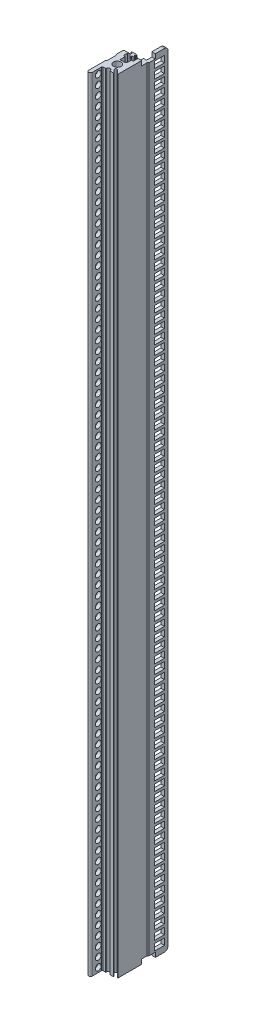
SolidWorks part; units mm, degrees
ref_plane "前视基准面" through (0, 0, 0) normal (0, 0, 1) x (1, 0, 0)
ref_plane "上视基准面" through (0, 0, 0) normal (0, 1, 0) x (1, 0, 0)
ref_plane "右视基准面" through (0, 0, 0) normal (1, 0, 0) x (0, 0, -1)
sketch "草图1" plane through (0, 0, 0) normal (0, 1, 0) x (1, 0, 0)
  line L0 (-4.2, 11.9) -> (-3.9, 11.9)
  line L1 (-4.4, 12.2) -> (-4.4, 12.1)
  line L2 (-4.0328, 12.4) -> (-4.2, 12.4)
  line L3 (-3.85, 12.5) -> (-3.8914, 12.4586)
  line L4 (-2.05, 12.5) -> (-3.85, 12.5)
  line L5 (-2.0086, 12.4586) -> (-2.05, 12.5)
  line L6 (-1.7, 12.4) -> (-1.8672, 12.4)
  line L7 (-1.5, 12.1) -> (-1.5, 12.2)
  line L8 (-1.8, 11.9) -> (-1.7, 11.9)
  line L9 (-2, 11.4828) -> (-2, 11.7)
  line L10 (-1.3586, 10.7586) -> (-1.9414, 11.3414)
  line L11 (-1.3, 10.55) -> (-1.3, 10.6172)
  line L12 (-3.7, 11.7) -> (-3.7, 9.95)
  line L13 (-5, -10.75) -> (-5, -1.6)
  line L14 (-3, -10.75) -> (-3, -5.75)
  line L15 (-2.5, -5.25) -> (-1.15, -5.25)
  line L16 (1.6887, -3.3855) -> (3.2118, -4.9086)
  line L17 (2.5373, -2.537) -> (4.6586, -4.6583)
  line L18 (5, 15) -> (5, 5.1793)
  line L19 (3.6, 15) -> (5, 15)
  line L20 (3.6, 12.5) -> (3.6, 15)
  line L21 (1.95, 12.5) -> (3.6, 12.5)
  line L22 (1.95, 10.55) -> (1.95, 12.5)
  line L23 (2.85, 10.55) -> (1.95, 10.55)
  line L24 (2.85, 9.35) -> (2.85, 10.55)
  line L25 (1.95, 9.35) -> (2.85, 9.35)
  line L26 (1.95, 8.35) -> (1.95, 9.35)
  line L27 (2.85, 8.35) -> (1.95, 8.35)
  line L28 (2.85, 6.05) -> (2.85, 8.35)
  line L29 (1.95, 6.05) -> (2.85, 6.05)
  line L30 (1.95, 3.8856) -> (1.95, 6.05)
  line L31 (-1.45, 6.05) -> (-1.45, 2.9458)
  line L32 (-2.35, 6.05) -> (-1.45, 6.05)
  line L33 (-2.35, 8.35) -> (-2.35, 6.05)
  line L34 (-1.45, 8.35) -> (-2.35, 8.35)
  line L35 (-1.45, 9.35) -> (-1.45, 8.35)
  line L36 (-2.35, 9.35) -> (-1.45, 9.35)
  line L37 (-2.35, 10.55) -> (-2.35, 9.35)
  line L38 (-1.3, 10.55) -> (-2.35, 10.55)
  line L39 (-4.45, 7.7) -> (-4.7, 7.7) construction
  line L40 (-5, 7.4) -> (-4.7, 7.7) construction
  line L41 (-5, 4.4) -> (-5, 7.4)
  line L42 (-4.5499, 3.8998) -> (-5, 4.4)
  line L43 (-4.45, 8.5) -> (-4.45, 9.55)
  line L44 (-3.9, 9.75) -> (-4.25, 9.75)
  line L45 (-4.5499, 3.8998) -> (-4.5501, -1.1002)
  line L46 (-5, -1.6) -> (-4.5501, -1.1002)
  line L47 (4.9414, -1.9395) -> (4.6464, -1.6446) construction
  line L48 (5, -2.081) -> (5, -4.5169)
  line L49 (0, 0) -> (0, -5) construction
  line L50 (4.5, -1.291) -> (4.5, 4.3894) construction
  line L51 (-1.05, -5) -> (-1.05, -5.15)
  line L52 (1.05, -5) -> (1.05, -5.15)
  line L53 (1.15, -5.25) -> (3.0703, -5.25)
  line L54 (2.5373, -2.537) -> (1.6887, -3.3855) construction
  line L55 (5, 5.1793) -> (5, -2.081)
  line L56 (-4.45, 8.5) -> (-4.7, 8.5)
  line L57 (-4.7, 8.5) -> (-5, 8.2)
  line L58 (4.9414, 5.0379) -> (4.6464, 4.743) construction
  line L59 (-5, 8.2) -> (-5, 7.4)
  circle A0 centre (0, 0) radius 1.6
  arc A1 (-4.4, 12.1) -> (-4.2, 11.9) centre (-4.2, 12.1) ccw
  arc A2 (-4.2, 12.4) -> (-4.4, 12.2) centre (-4.2, 12.2) ccw
  arc A3 (-4.0328, 12.4) -> (-3.8914, 12.4586) centre (-4.0328, 12.6) ccw
  arc A4 (-2.0086, 12.4586) -> (-1.8672, 12.4) centre (-1.8672, 12.6) ccw
  arc A5 (-1.5, 12.2) -> (-1.7, 12.4) centre (-1.7, 12.2) ccw
  arc A6 (-1.7, 11.9) -> (-1.5, 12.1) centre (-1.7, 12.1) ccw
  arc A7 (-1.8, 11.9) -> (-2, 11.7) centre (-1.8, 11.7) ccw
  arc A8 (-2, 11.4828) -> (-1.9414, 11.3414) centre (-1.8, 11.4828) ccw
  arc A9 (-1.3, 10.6172) -> (-1.3586, 10.7586) centre (-1.5, 10.6172) ccw
  arc A10 (-5, -10.75) -> (-3, -10.75) centre (-4, -10.75) ccw
  arc A11 (3.0703, -5.25) -> (3.2118, -4.9086) centre (3.0703, -5.05) ccw
  arc A12 (-4.25, 9.75) -> (-4.45, 9.55) centre (-4.25, 9.55) ccw
  arc A13 (-3.9, 9.75) -> (-3.7, 9.95) centre (-3.9, 9.95) ccw
  arc A14 (5, -2.081) -> (4.9414, -1.9395) centre (4.8, -2.081) ccw construction
  arc A15 (4.9414, 5.0379) -> (5, 5.1793) centre (4.8, 5.1793) ccw construction
  arc A16 (4.6586, -4.6583) -> (5, -4.5169) centre (4.8, -4.5169) ccw
  arc A17 (2.5373, -2.537) -> (1.6887, -3.3855) centre (2.113, -2.9613) ccw
  arc A18 (0.7125, 2.9142) -> (-1.1719, 2.7616) centre (0, 0) ccw
  arc A19 (-1.45, 2.9458) -> (-1.1719, 2.7616) centre (-1.25, 2.9458) ccw
  arc A20 (0.7125, 2.9142) -> (1.95, 3.8856) centre (0.95, 3.8856) ccw
  arc A21 (-3.7, 11.7) -> (-3.9, 11.9) centre (-3.9, 11.7) ccw
  arc A22 (4.6464, -1.6446) -> (4.5, -1.291) centre (5, -1.291) cw construction
  arc A23 (4.5, 4.3894) -> (4.6464, 4.743) centre (5, 4.3894) cw construction
  arc A24 (1.05, -5) -> (-1.05, -5) centre (0, -5) ccw
  arc A25 (1.15, -5.25) -> (1.05, -5.15) centre (1.15, -5.15) cw
  arc A26 (-1.05, -5.15) -> (-1.15, -5.25) centre (-1.15, -5.15) cw
  arc A29 (-3, -5.75) -> (-2.5, -5.25) centre (-2.5, -5.75) cw
  point P104 (1.05, -5.25)
  dimension "D1" = 3.2
  dimension "D2" = 2.1
  dimension "D3" = 5.2
  dimension "D4" = 45
  dimension "D5" = 1.2
  dimension "D7" = 0.6
  dimension "D8" = 0.2
  dimension "D10" = 5
  dimension "D11" = 0.1
  dimension "D12" = 0.5
  dimension "D13" = 0.5
  dimension "D6" = 3
  dimension "D9" = 2.1225
  dimension "D14" = 0.25
  dimension "D15" = 0.8
extrude "凸台-拉伸1" add sketch "草图1" along normal mid plane 431.8
sketch "草图8" plane through (0, -215.9, 0) normal (0, -1, 0) x (-1, 0, 0)
  line L0 (2.35, 8.35) -> (1.45, 8.35) construction
  line L1 (-2.95, 5.85) -> (2.45, 5.85)
  line L2 (-2.95, 5.85) -> (-2.95, 8.35)
  line L3 (-2.95, 8.35) -> (2.45, 8.35)
  line L4 (2.45, 5.85) -> (2.45, 8.35)
  line L5 (-2.85, 8.35) -> (-2.85, 6.05) construction
  line L6 (2.35, 6.05) -> (2.35, 8.35) construction
  line L7 (1.45, 6.05) -> (2.35, 6.05) construction
  line L8 (-2.85, 9.35) -> (-1.95, 9.35) construction
  line L9 (-2.95, 9.35) -> (2.45, 9.35)
  line L10 (-2.95, 9.35) -> (-2.95, 10.55)
  line L11 (-2.95, 10.55) -> (2.45, 10.55)
  line L12 (2.45, 9.35) -> (2.45, 10.55)
  line L13 (2.35, 10.55) -> (1.3, 10.55) construction
  line L14 (-2.85, 10.55) -> (-2.85, 9.35) construction
  line L15 (2.35, 9.35) -> (2.35, 10.55) construction
  dimension "D1" = 0.1
  dimension "D2" = 0.1
  dimension "D3" = 0.2
  dimension "D4" = 0.1
  dimension "D5" = 0.1
extrude "切除-拉伸6" cut sketch "草图8" against normal through all
fillet "圆角2" radius 0.2 8 edges at (-2.45, 0, -5.85) (2.95, 0, -8.35) (2.95, 0, -5.85) (-2.45, 0, -8.35) (-2.45, 0, -9.35) (2.95, 0, -10.55) (2.95, 0, -9.35) (-2.45, 0, -10.55)
sketch "草图6" plane through (0, 215.9, 0) normal (0, 1, 0) x (1, 0, 0)
  line L0 (3.6, 12.5) -> (3.6, 22.5)
  line L1 (3.6, 22.5) -> (5.5, 22.5)
  line L2 (5.5, 22.5) -> (5.5, 12)
  line L3 (5.5, 12) -> (5, 11.5)
  line L4 (3.6, 12.5) -> (5, 11.5)
  line L5 (5, -4.5169) -> (5, 15) construction
  line L6 (-5, 8.2) -> (-5, 4.4) construction
  dimension "D4" = 11
  dimension "D1" = 10.5
  dimension "D2" = 10
  dimension "D3" = 45
extrude "凸台-拉伸2" add sketch "草图6" against normal up to surface (431.8 mm away)
sketch "草图2" plane through (0, 215.9, 0) normal (0, 1, 0) x (1, 0, 0)
  circle A0 centre (0, 0) radius 2.1
  dimension "D1" = 4.2
extrude "切除-拉伸1" cut sketch "草图2" against normal blind 10
sketch "草图3" plane through (0, -215.9, 0) normal (0, -1, 0) x (1, 0, 0)
  circle A0 centre (0, 0) radius 2.1
  dimension "D1" = 4.2
extrude "切除-拉伸2" cut sketch "草图3" against normal blind 10
sketch "草图4" plane through (-5, 0, 0) normal (-1, 0, 0) x (0, 0, 1)
  line L0 (1.6, -215.9) -> (10.75, -215.9) construction
  line L1 (11.75, -215.9) -> (11.75, 215.9) construction
  circle A0 centre (7.5, -213.36) radius 1.65
  circle A1 centre (7.5, -208.28) radius 1.65
  circle A2 centre (7.5, -203.2) radius 1.65
  circle A3 centre (7.5, -198.12) radius 1.65
  circle A4 centre (7.5, -193.04) radius 1.65
  circle A5 centre (7.5, -187.96) radius 1.65
  circle A6 centre (7.5, -182.88) radius 1.65
  circle A7 centre (7.5, -177.8) radius 1.65
  circle A8 centre (7.5, -172.72) radius 1.65
  circle A9 centre (7.5, -167.64) radius 1.65
  circle A10 centre (7.5, -162.56) radius 1.65
  circle A11 centre (7.5, -157.48) radius 1.65
  circle A12 centre (7.5, -152.4) radius 1.65
  circle A13 centre (7.5, -147.32) radius 1.65
  circle A14 centre (7.5, -142.24) radius 1.65
  circle A15 centre (7.5, -137.16) radius 1.65
  circle A16 centre (7.5, -132.08) radius 1.65
  circle A17 centre (7.5, -127) radius 1.65
  circle A18 centre (7.5, -121.92) radius 1.65
  circle A19 centre (7.5, -116.84) radius 1.65
  circle A20 centre (7.5, -111.76) radius 1.65
  circle A21 centre (7.5, -106.68) radius 1.65
  circle A22 centre (7.5, -101.6) radius 1.65
  circle A23 centre (7.5, -96.52) radius 1.65
  circle A24 centre (7.5, -91.44) radius 1.65
  circle A25 centre (7.5, -86.36) radius 1.65
  circle A26 centre (7.5, -81.28) radius 1.65
  circle A27 centre (7.5, -76.2) radius 1.65
  circle A28 centre (7.5, -71.12) radius 1.65
  circle A29 centre (7.5, -66.04) radius 1.65
  circle A30 centre (7.5, -60.96) radius 1.65
  circle A31 centre (7.5, -55.88) radius 1.65
  circle A32 centre (7.5, -50.8) radius 1.65
  circle A33 centre (7.5, -45.72) radius 1.65
  circle A34 centre (7.5, -40.64) radius 1.65
  circle A35 centre (7.5, -35.56) radius 1.65
  circle A36 centre (7.5, -30.48) radius 1.65
  circle A37 centre (7.5, -25.4) radius 1.65
  circle A38 centre (7.5, -20.32) radius 1.65
  circle A39 centre (7.5, -15.24) radius 1.65
  circle A40 centre (7.5, -10.16) radius 1.65
  circle A41 centre (7.5, -5.08) radius 1.65
  circle A42 centre (7.5, 0) radius 1.65
  circle A43 centre (7.5, 5.08) radius 1.65
  circle A44 centre (7.5, 10.16) radius 1.65
  circle A45 centre (7.5, 15.24) radius 1.65
  circle A46 centre (7.5, 20.32) radius 1.65
  circle A47 centre (7.5, 25.4) radius 1.65
  circle A48 centre (7.5, 30.48) radius 1.65
  circle A49 centre (7.5, 35.56) radius 1.65
  circle A50 centre (7.5, 40.64) radius 1.65
  circle A51 centre (7.5, 45.72) radius 1.65
  circle A52 centre (7.5, 50.8) radius 1.65
  circle A53 centre (7.5, 55.88) radius 1.65
  circle A54 centre (7.5, 60.96) radius 1.65
  circle A55 centre (7.5, 66.04) radius 1.65
  circle A56 centre (7.5, 71.12) radius 1.65
  circle A57 centre (7.5, 76.2) radius 1.65
  circle A58 centre (7.5, 81.28) radius 1.65
  circle A59 centre (7.5, 86.36) radius 1.65
  circle A60 centre (7.5, 91.44) radius 1.65
  circle A61 centre (7.5, 96.52) radius 1.65
  circle A62 centre (7.5, 101.6) radius 1.65
  circle A63 centre (7.5, 106.68) radius 1.65
  circle A64 centre (7.5, 111.76) radius 1.65
  circle A65 centre (7.5, 116.84) radius 1.65
  circle A66 centre (7.5, 121.92) radius 1.65
  circle A67 centre (7.5, 127) radius 1.65
  circle A68 centre (7.5, 132.08) radius 1.65
  circle A69 centre (7.5, 137.16) radius 1.65
  circle A70 centre (7.5, 142.24) radius 1.65
  circle A71 centre (7.5, 147.32) radius 1.65
  circle A72 centre (7.5, 152.4) radius 1.65
  circle A73 centre (7.5, 157.48) radius 1.65
  circle A74 centre (7.5, 162.56) radius 1.65
  circle A75 centre (7.5, 167.64) radius 1.65
  circle A76 centre (7.5, 172.72) radius 1.65
  circle A77 centre (7.5, 177.8) radius 1.65
  circle A78 centre (7.5, 182.88) radius 1.65
  circle A79 centre (7.5, 187.96) radius 1.65
  circle A80 centre (7.5, 193.04) radius 1.65
  circle A81 centre (7.5, 198.12) radius 1.65
  circle A82 centre (7.5, 203.2) radius 1.65
  circle A83 centre (7.5, 208.28) radius 1.65
  circle A84 centre (7.5, 213.36) radius 1.65
  dimension "D1" = 2.54
  dimension "D2" = 4.25
  dimension "D3" = 3.3
  dimension "D5" = 5.08
  dimension "D4" = 85
extrude "切除-拉伸3" cut sketch "草图4" against normal blind 12
sketch "草图5" plane through (5.5, 0, 0) normal (1, 0, 0) x (0, 0, -1)
  line L0 (-19.1753, 0) -> (41.1348, 0) construction
  line L1 (15.5, 215.9) -> (8.5, 215.9)
  line L2 (15.5, 215.9) -> (15.5, 213.36)
  line L3 (15.5, 213.36) -> (8.5, 213.36)
  line L4 (8.5, 215.9) -> (8.5, 213.36)
  line L6 (8.5, -215.9) -> (8.5, -213.36)
  line L7 (15.5, -213.36) -> (8.5, -213.36)
  line L8 (15.5, -215.9) -> (15.5, -213.36)
  line L9 (15.5, -215.9) -> (8.5, -215.9)
  line L10 (12, 215.9) -> (22.5, 215.9) construction
  line L11 (22.5, -215.9) -> (22.5, 215.9) construction
  dimension "D1" = 7
  dimension "D2" = 2.54
  dimension "D3" = 7
extrude "切除-拉伸4" cut sketch "草图5" against normal through all
sketch "草图7" plane through (5.5, 0, 0) normal (1, 0, 0) x (0, 0, -1)
  line L0 (22.5, -215.9) -> (22.5, 215.9) construction
  line L1 (15, -212.62) -> (20.5, -212.62)
  line L2 (15, -212.62) -> (15, -209.02)
  line L3 (15, -209.02) -> (20.5, -209.02)
  line L4 (20.5, -212.62) -> (20.5, -209.02)
  line L5 (22.5, -215.9) -> (15.5, -215.9) construction
  line L6 (15, -207.54) -> (20.5, -207.54)
  line L7 (15, -207.54) -> (15, -203.94)
  line L8 (15, -203.94) -> (20.5, -203.94)
  line L9 (20.5, -207.54) -> (20.5, -203.94)
  line L10 (15, -202.46) -> (20.5, -202.46)
  line L11 (15, -202.46) -> (15, -198.86)
  line L12 (15, -198.86) -> (20.5, -198.86)
  line L13 (20.5, -202.46) -> (20.5, -198.86)
  line L14 (15, -197.38) -> (20.5, -197.38)
  line L15 (15, -197.38) -> (15, -193.78)
  line L16 (15, -193.78) -> (20.5, -193.78)
  line L17 (20.5, -197.38) -> (20.5, -193.78)
  line L18 (15, -192.3) -> (20.5, -192.3)
  line L19 (15, -192.3) -> (15, -188.7)
  line L20 (15, -188.7) -> (20.5, -188.7)
  line L21 (20.5, -192.3) -> (20.5, -188.7)
  line L22 (15, -187.22) -> (20.5, -187.22)
  line L23 (15, -187.22) -> (15, -183.62)
  line L24 (15, -183.62) -> (20.5, -183.62)
  line L25 (20.5, -187.22) -> (20.5, -183.62)
  line L26 (15, -182.14) -> (20.5, -182.14)
  line L27 (15, -182.14) -> (15, -178.54)
  line L28 (15, -178.54) -> (20.5, -178.54)
  line L29 (20.5, -182.14) -> (20.5, -178.54)
  line L30 (15, -177.06) -> (20.5, -177.06)
  line L31 (15, -177.06) -> (15, -173.46)
  line L32 (15, -173.46) -> (20.5, -173.46)
  line L33 (20.5, -177.06) -> (20.5, -173.46)
  line L34 (15, -171.98) -> (20.5, -171.98)
  line L35 (15, -171.98) -> (15, -168.38)
  line L36 (15, -168.38) -> (20.5, -168.38)
  line L37 (20.5, -171.98) -> (20.5, -168.38)
  line L38 (15, -166.9) -> (20.5, -166.9)
  line L39 (15, -166.9) -> (15, -163.3)
  line L40 (15, -163.3) -> (20.5, -163.3)
  line L41 (20.5, -166.9) -> (20.5, -163.3)
  line L42 (15, -161.82) -> (20.5, -161.82)
  line L43 (15, -161.82) -> (15, -158.22)
  line L44 (15, -158.22) -> (20.5, -158.22)
  line L45 (20.5, -161.82) -> (20.5, -158.22)
  line L46 (15, -156.74) -> (20.5, -156.74)
  line L47 (15, -156.74) -> (15, -153.14)
  line L48 (15, -153.14) -> (20.5, -153.14)
  line L49 (20.5, -156.74) -> (20.5, -153.14)
  line L50 (15, -151.66) -> (20.5, -151.66)
  line L51 (15, -151.66) -> (15, -148.06)
  line L52 (15, -148.06) -> (20.5, -148.06)
  line L53 (20.5, -151.66) -> (20.5, -148.06)
  line L54 (15, -146.58) -> (20.5, -146.58)
  line L55 (15, -146.58) -> (15, -142.98)
  line L56 (15, -142.98) -> (20.5, -142.98)
  line L57 (20.5, -146.58) -> (20.5, -142.98)
  line L58 (15, -141.5) -> (20.5, -141.5)
  line L59 (15, -141.5) -> (15, -137.9)
  line L60 (15, -137.9) -> (20.5, -137.9)
  line L61 (20.5, -141.5) -> (20.5, -137.9)
  line L62 (15, -136.42) -> (20.5, -136.42)
  line L63 (15, -136.42) -> (15, -132.82)
  line L64 (15, -132.82) -> (20.5, -132.82)
  line L65 (20.5, -136.42) -> (20.5, -132.82)
  line L66 (15, -131.34) -> (20.5, -131.34)
  line L67 (15, -131.34) -> (15, -127.74)
  line L68 (15, -127.74) -> (20.5, -127.74)
  line L69 (20.5, -131.34) -> (20.5, -127.74)
  line L70 (15, -126.26) -> (20.5, -126.26)
  line L71 (15, -126.26) -> (15, -122.66)
  line L72 (15, -122.66) -> (20.5, -122.66)
  line L73 (20.5, -126.26) -> (20.5, -122.66)
  line L74 (15, -121.18) -> (20.5, -121.18)
  line L75 (15, -121.18) -> (15, -117.58)
  line L76 (15, -117.58) -> (20.5, -117.58)
  line L77 (20.5, -121.18) -> (20.5, -117.58)
  line L78 (15, -116.1) -> (20.5, -116.1)
  line L79 (15, -116.1) -> (15, -112.5)
  line L80 (15, -112.5) -> (20.5, -112.5)
  line L81 (20.5, -116.1) -> (20.5, -112.5)
  line L82 (15, -111.02) -> (20.5, -111.02)
  line L83 (15, -111.02) -> (15, -107.42)
  line L84 (15, -107.42) -> (20.5, -107.42)
  line L85 (20.5, -111.02) -> (20.5, -107.42)
  line L86 (15, -105.94) -> (20.5, -105.94)
  line L87 (15, -105.94) -> (15, -102.34)
  line L88 (15, -102.34) -> (20.5, -102.34)
  line L89 (20.5, -105.94) -> (20.5, -102.34)
  line L90 (15, -100.86) -> (20.5, -100.86)
  line L91 (15, -100.86) -> (15, -97.26)
  line L92 (15, -97.26) -> (20.5, -97.26)
  line L93 (20.5, -100.86) -> (20.5, -97.26)
  line L94 (15, -95.78) -> (20.5, -95.78)
  line L95 (15, -95.78) -> (15, -92.18)
  line L96 (15, -92.18) -> (20.5, -92.18)
  line L97 (20.5, -95.78) -> (20.5, -92.18)
  line L98 (15, -90.7) -> (20.5, -90.7)
  line L99 (15, -90.7) -> (15, -87.1)
  line L100 (15, -87.1) -> (20.5, -87.1)
  line L101 (20.5, -90.7) -> (20.5, -87.1)
  line L102 (15, -85.62) -> (20.5, -85.62)
  line L103 (15, -85.62) -> (15, -82.02)
  line L104 (15, -82.02) -> (20.5, -82.02)
  line L105 (20.5, -85.62) -> (20.5, -82.02)
  line L106 (15, -80.54) -> (20.5, -80.54)
  line L107 (15, -80.54) -> (15, -76.94)
  line L108 (15, -76.94) -> (20.5, -76.94)
  line L109 (20.5, -80.54) -> (20.5, -76.94)
  line L110 (15, -75.46) -> (20.5, -75.46)
  line L111 (15, -75.46) -> (15, -71.86)
  line L112 (15, -71.86) -> (20.5, -71.86)
  line L113 (20.5, -75.46) -> (20.5, -71.86)
  line L114 (15, -70.38) -> (20.5, -70.38)
  line L115 (15, -70.38) -> (15, -66.78)
  line L116 (15, -66.78) -> (20.5, -66.78)
  line L117 (20.5, -70.38) -> (20.5, -66.78)
  line L118 (15, -65.3) -> (20.5, -65.3)
  line L119 (15, -65.3) -> (15, -61.7)
  line L120 (15, -61.7) -> (20.5, -61.7)
  line L121 (20.5, -65.3) -> (20.5, -61.7)
  line L122 (15, -60.22) -> (20.5, -60.22)
  line L123 (15, -60.22) -> (15, -56.62)
  line L124 (15, -56.62) -> (20.5, -56.62)
  line L125 (20.5, -60.22) -> (20.5, -56.62)
  line L126 (15, -55.14) -> (20.5, -55.14)
  line L127 (15, -55.14) -> (15, -51.54)
  line L128 (15, -51.54) -> (20.5, -51.54)
  line L129 (20.5, -55.14) -> (20.5, -51.54)
  line L130 (15, -50.06) -> (20.5, -50.06)
  line L131 (15, -50.06) -> (15, -46.46)
  line L132 (15, -46.46) -> (20.5, -46.46)
  line L133 (20.5, -50.06) -> (20.5, -46.46)
  line L134 (15, -44.98) -> (20.5, -44.98)
  line L135 (15, -44.98) -> (15, -41.38)
  line L136 (15, -41.38) -> (20.5, -41.38)
  line L137 (20.5, -44.98) -> (20.5, -41.38)
  line L138 (15, -39.9) -> (20.5, -39.9)
  line L139 (15, -39.9) -> (15, -36.3)
  line L140 (15, -36.3) -> (20.5, -36.3)
  line L141 (20.5, -39.9) -> (20.5, -36.3)
  line L142 (15, -34.82) -> (20.5, -34.82)
  line L143 (15, -34.82) -> (15, -31.22)
  line L144 (15, -31.22) -> (20.5, -31.22)
  line L145 (20.5, -34.82) -> (20.5, -31.22)
  line L146 (15, -29.74) -> (20.5, -29.74)
  line L147 (15, -29.74) -> (15, -26.14)
  line L148 (15, -26.14) -> (20.5, -26.14)
  line L149 (20.5, -29.74) -> (20.5, -26.14)
  line L150 (15, -24.66) -> (20.5, -24.66)
  line L151 (15, -24.66) -> (15, -21.06)
  line L152 (15, -21.06) -> (20.5, -21.06)
  line L153 (20.5, -24.66) -> (20.5, -21.06)
  line L154 (15, -19.58) -> (20.5, -19.58)
  line L155 (15, -19.58) -> (15, -15.98)
  line L156 (15, -15.98) -> (20.5, -15.98)
  line L157 (20.5, -19.58) -> (20.5, -15.98)
  line L158 (15, -14.5) -> (20.5, -14.5)
  line L159 (15, -14.5) -> (15, -10.9)
  line L160 (15, -10.9) -> (20.5, -10.9)
  line L161 (20.5, -14.5) -> (20.5, -10.9)
  line L162 (15, -9.42) -> (20.5, -9.42)
  line L163 (15, -9.42) -> (15, -5.82)
  line L164 (15, -5.82) -> (20.5, -5.82)
  line L165 (20.5, -9.42) -> (20.5, -5.82)
  line L166 (15, -4.34) -> (20.5, -4.34)
  line L167 (15, -4.34) -> (15, -0.74)
  line L168 (15, -0.74) -> (20.5, -0.74)
  line L169 (20.5, -4.34) -> (20.5, -0.74)
  line L170 (15, 0.74) -> (20.5, 0.74)
  line L171 (15, 0.74) -> (15, 4.34)
  line L172 (15, 4.34) -> (20.5, 4.34)
  line L173 (20.5, 0.74) -> (20.5, 4.34)
  line L174 (15, 5.82) -> (20.5, 5.82)
  line L175 (15, 5.82) -> (15, 9.42)
  line L176 (15, 9.42) -> (20.5, 9.42)
  line L177 (20.5, 5.82) -> (20.5, 9.42)
  line L178 (15, 10.9) -> (20.5, 10.9)
  line L179 (15, 10.9) -> (15, 14.5)
  line L180 (15, 14.5) -> (20.5, 14.5)
  line L181 (20.5, 10.9) -> (20.5, 14.5)
  line L182 (15, 15.98) -> (20.5, 15.98)
  line L183 (15, 15.98) -> (15, 19.58)
  line L184 (15, 19.58) -> (20.5, 19.58)
  line L185 (20.5, 15.98) -> (20.5, 19.58)
  line L186 (15, 21.06) -> (20.5, 21.06)
  line L187 (15, 21.06) -> (15, 24.66)
  line L188 (15, 24.66) -> (20.5, 24.66)
  line L189 (20.5, 21.06) -> (20.5, 24.66)
  line L190 (15, 26.14) -> (20.5, 26.14)
  line L191 (15, 26.14) -> (15, 29.74)
  line L192 (15, 29.74) -> (20.5, 29.74)
  line L193 (20.5, 26.14) -> (20.5, 29.74)
  line L194 (15, 31.22) -> (20.5, 31.22)
  line L195 (15, 31.22) -> (15, 34.82)
  line L196 (15, 34.82) -> (20.5, 34.82)
  line L197 (20.5, 31.22) -> (20.5, 34.82)
  line L198 (15, 36.3) -> (20.5, 36.3)
  line L199 (15, 36.3) -> (15, 39.9)
  line L200 (15, 39.9) -> (20.5, 39.9)
  line L201 (20.5, 36.3) -> (20.5, 39.9)
  line L202 (15, 41.38) -> (20.5, 41.38)
  line L203 (15, 41.38) -> (15, 44.98)
  line L204 (15, 44.98) -> (20.5, 44.98)
  line L205 (20.5, 41.38) -> (20.5, 44.98)
  line L206 (15, 46.46) -> (20.5, 46.46)
  line L207 (15, 46.46) -> (15, 50.06)
  line L208 (15, 50.06) -> (20.5, 50.06)
  line L209 (20.5, 46.46) -> (20.5, 50.06)
  line L210 (15, 51.54) -> (20.5, 51.54)
  line L211 (15, 51.54) -> (15, 55.14)
  line L212 (15, 55.14) -> (20.5, 55.14)
  line L213 (20.5, 51.54) -> (20.5, 55.14)
  line L214 (15, 56.62) -> (20.5, 56.62)
  line L215 (15, 56.62) -> (15, 60.22)
  line L216 (15, 60.22) -> (20.5, 60.22)
  line L217 (20.5, 56.62) -> (20.5, 60.22)
  line L218 (15, 61.7) -> (20.5, 61.7)
  line L219 (15, 61.7) -> (15, 65.3)
  line L220 (15, 65.3) -> (20.5, 65.3)
  line L221 (20.5, 61.7) -> (20.5, 65.3)
  line L222 (15, 66.78) -> (20.5, 66.78)
  line L223 (15, 66.78) -> (15, 70.38)
  line L224 (15, 70.38) -> (20.5, 70.38)
  line L225 (20.5, 66.78) -> (20.5, 70.38)
  line L226 (15, 71.86) -> (20.5, 71.86)
  line L227 (15, 71.86) -> (15, 75.46)
  line L228 (15, 75.46) -> (20.5, 75.46)
  line L229 (20.5, 71.86) -> (20.5, 75.46)
  line L230 (15, 76.94) -> (20.5, 76.94)
  line L231 (15, 76.94) -> (15, 80.54)
  line L232 (15, 80.54) -> (20.5, 80.54)
  line L233 (20.5, 76.94) -> (20.5, 80.54)
  line L234 (15, 82.02) -> (20.5, 82.02)
  line L235 (15, 82.02) -> (15, 85.62)
  line L236 (15, 85.62) -> (20.5, 85.62)
  line L237 (20.5, 82.02) -> (20.5, 85.62)
  line L238 (15, 87.1) -> (20.5, 87.1)
  line L239 (15, 87.1) -> (15, 90.7)
  line L240 (15, 90.7) -> (20.5, 90.7)
  line L241 (20.5, 87.1) -> (20.5, 90.7)
  line L242 (15, 92.18) -> (20.5, 92.18)
  line L243 (15, 92.18) -> (15, 95.78)
  line L244 (15, 95.78) -> (20.5, 95.78)
  line L245 (20.5, 92.18) -> (20.5, 95.78)
  line L246 (15, 97.26) -> (20.5, 97.26)
  line L247 (15, 97.26) -> (15, 100.86)
  line L248 (15, 100.86) -> (20.5, 100.86)
  line L249 (20.5, 97.26) -> (20.5, 100.86)
  line L250 (15, 102.34) -> (20.5, 102.34)
  line L251 (15, 102.34) -> (15, 105.94)
  line L252 (15, 105.94) -> (20.5, 105.94)
  line L253 (20.5, 102.34) -> (20.5, 105.94)
  line L254 (15, 107.42) -> (20.5, 107.42)
  line L255 (15, 107.42) -> (15, 111.02)
  line L256 (15, 111.02) -> (20.5, 111.02)
  line L257 (20.5, 107.42) -> (20.5, 111.02)
  line L258 (15, 112.5) -> (20.5, 112.5)
  line L259 (15, 112.5) -> (15, 116.1)
  line L260 (15, 116.1) -> (20.5, 116.1)
  line L261 (20.5, 112.5) -> (20.5, 116.1)
  line L262 (15, 117.58) -> (20.5, 117.58)
  line L263 (15, 117.58) -> (15, 121.18)
  line L264 (15, 121.18) -> (20.5, 121.18)
  line L265 (20.5, 117.58) -> (20.5, 121.18)
  line L266 (15, 122.66) -> (20.5, 122.66)
  line L267 (15, 122.66) -> (15, 126.26)
  line L268 (15, 126.26) -> (20.5, 126.26)
  line L269 (20.5, 122.66) -> (20.5, 126.26)
  line L270 (15, 127.74) -> (20.5, 127.74)
  line L271 (15, 127.74) -> (15, 131.34)
  line L272 (15, 131.34) -> (20.5, 131.34)
  line L273 (20.5, 127.74) -> (20.5, 131.34)
  line L274 (15, 132.82) -> (20.5, 132.82)
  line L275 (15, 132.82) -> (15, 136.42)
  line L276 (15, 136.42) -> (20.5, 136.42)
  line L277 (20.5, 132.82) -> (20.5, 136.42)
  line L278 (15, 137.9) -> (20.5, 137.9)
  line L279 (15, 137.9) -> (15, 141.5)
  line L280 (15, 141.5) -> (20.5, 141.5)
  line L281 (20.5, 137.9) -> (20.5, 141.5)
  line L282 (15, 142.98) -> (20.5, 142.98)
  line L283 (15, 142.98) -> (15, 146.58)
  line L284 (15, 146.58) -> (20.5, 146.58)
  line L285 (20.5, 142.98) -> (20.5, 146.58)
  line L286 (15, 148.06) -> (20.5, 148.06)
  line L287 (15, 148.06) -> (15, 151.66)
  line L288 (15, 151.66) -> (20.5, 151.66)
  line L289 (20.5, 148.06) -> (20.5, 151.66)
  line L290 (15, 153.14) -> (20.5, 153.14)
  line L291 (15, 153.14) -> (15, 156.74)
  line L292 (15, 156.74) -> (20.5, 156.74)
  line L293 (20.5, 153.14) -> (20.5, 156.74)
  line L294 (15, 158.22) -> (20.5, 158.22)
  line L295 (15, 158.22) -> (15, 161.82)
  line L296 (15, 161.82) -> (20.5, 161.82)
  line L297 (20.5, 158.22) -> (20.5, 161.82)
  line L298 (15, 163.3) -> (20.5, 163.3)
  line L299 (15, 163.3) -> (15, 166.9)
  line L300 (15, 166.9) -> (20.5, 166.9)
  line L301 (20.5, 163.3) -> (20.5, 166.9)
  line L302 (15, 168.38) -> (20.5, 168.38)
  line L303 (15, 168.38) -> (15, 171.98)
  line L304 (15, 171.98) -> (20.5, 171.98)
  line L305 (20.5, 168.38) -> (20.5, 171.98)
  line L306 (15, 173.46) -> (20.5, 173.46)
  line L307 (15, 173.46) -> (15, 177.06)
  line L308 (15, 177.06) -> (20.5, 177.06)
  line L309 (20.5, 173.46) -> (20.5, 177.06)
  line L310 (15, 178.54) -> (20.5, 178.54)
  line L311 (15, 178.54) -> (15, 182.14)
  line L312 (15, 182.14) -> (20.5, 182.14)
  line L313 (20.5, 178.54) -> (20.5, 182.14)
  line L314 (15, 183.62) -> (20.5, 183.62)
  line L315 (15, 183.62) -> (15, 187.22)
  line L316 (15, 187.22) -> (20.5, 187.22)
  line L317 (20.5, 183.62) -> (20.5, 187.22)
  line L318 (15, 188.7) -> (20.5, 188.7)
  line L319 (15, 188.7) -> (15, 192.3)
  line L320 (15, 192.3) -> (20.5, 192.3)
  line L321 (20.5, 188.7) -> (20.5, 192.3)
  line L322 (15, 193.78) -> (20.5, 193.78)
  line L323 (15, 193.78) -> (15, 197.38)
  line L324 (15, 197.38) -> (20.5, 197.38)
  line L325 (20.5, 193.78) -> (20.5, 197.38)
  line L326 (15, 198.86) -> (20.5, 198.86)
  line L327 (15, 198.86) -> (15, 202.46)
  line L328 (15, 202.46) -> (20.5, 202.46)
  line L329 (20.5, 198.86) -> (20.5, 202.46)
  line L330 (15, 203.94) -> (20.5, 203.94)
  line L331 (15, 203.94) -> (15, 207.54)
  line L332 (15, 207.54) -> (20.5, 207.54)
  line L333 (20.5, 203.94) -> (20.5, 207.54)
  line L334 (15, 209.02) -> (20.5, 209.02)
  line L335 (15, 209.02) -> (15, 212.62)
  line L336 (15, 212.62) -> (20.5, 212.62)
  line L337 (20.5, 209.02) -> (20.5, 212.62)
  dimension "D1" = 3.6
  dimension "D2" = 5.5
  dimension "D3" = 2
  dimension "D4" = 3.28
  dimension "D5" = 84
extrude "切除-拉伸5" cut sketch "草图7" against normal blind 10
fillet "圆角1" radius 2 2 edges at (4.55, -215.9, -22.5) (4.55, 215.9, -22.5)
